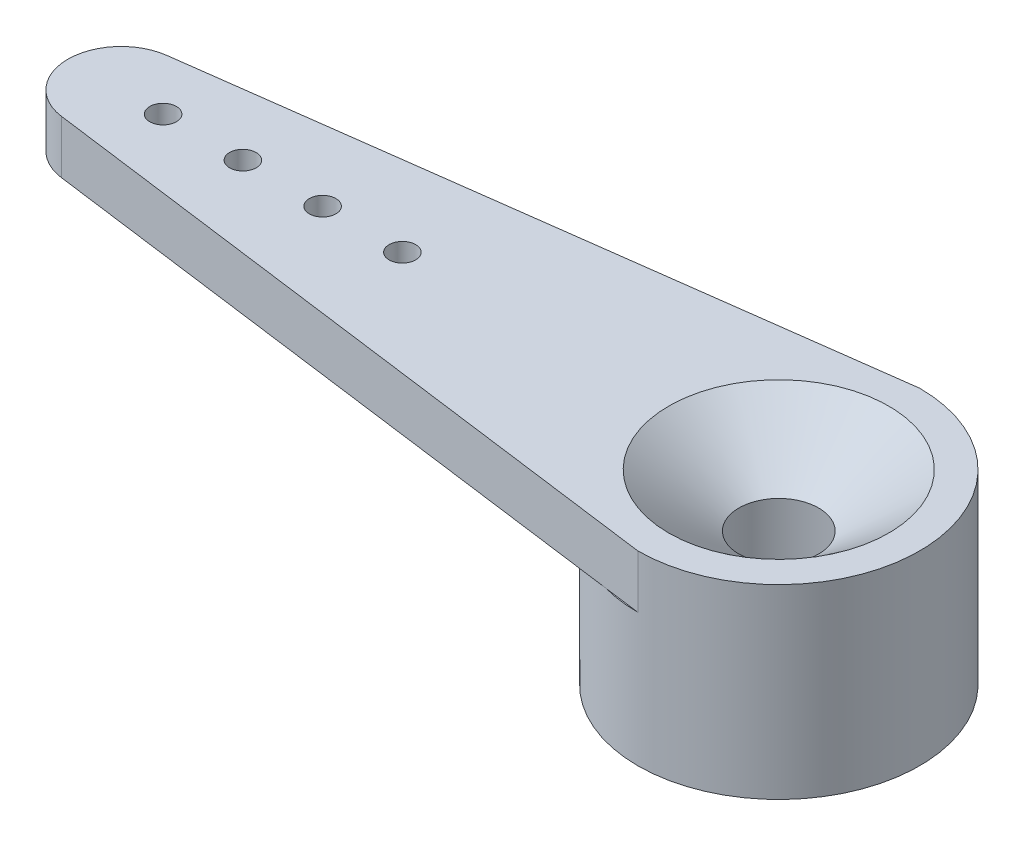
SolidWorks part; units mm, degrees
ref_plane "Front Plane" through (0, 0, 0) normal (0, 0, 1) x (1, 0, 0)
ref_plane "Top Plane" through (0, 0, 0) normal (0, 1, 0) x (1, 0, 0)
ref_plane "Right Plane" through (0, 0, 0) normal (1, 0, 0) x (0, 0, -1)
sketch "Sketch1" plane through (0, 0, 0) normal (0, 1, 0) x (1, 0, 0)
  circle A0 centre (0, 0) radius 2.8
  circle A1 centre (0, 0) radius 5.3
  dimension "D1" = 5.6
  dimension "D2" = 2.5
extrude "Boss-Extrude1" add sketch "Sketch1" along normal blind 5
sketch "Sketch4" plane through (0, 5, 0) normal (0, 1, 0) x (1, 0, 0)
  circle A0 centre (0, 0) radius 1.5
  dimension "D1" = 3
sketch "Sketch2" plane through (0, 5, 0) normal (0, 1, 0) x (1, 0, 0)
  line L0 (0, 5.3) -> (-25, 1.9824)
  line L1 (0, -5.3) -> (-25, -1.9824)
  circle A0 centre (0, 0) radius 5.3 construction
  arc A1 (-25, -1.9824) -> (-25, 1.9824) centre (-24.7354, 0) cw
  arc A2 (0, 5.3) -> (0, -5.3) centre (0, 0) cw
  point P8 (0, 0)
  dimension "D3" = 2
  dimension "D1" = 25
  dimension "D2" = 25
extrude "Boss-Extrude2" add sketch "Sketch2" along normal blind 2
sketch "Sketch3" plane through (0, 7, 0) normal (0, 1, 0) x (1, 0, 0)
  circle A0 centre (0, 0) radius 4.1381
loft "Cut-Loft2" cut profiles "Sketch3", "Sketch4"
sketch "Sketch5" plane through (0, 7, 0) normal (0, 1, 0) x (1, 0, 0)
  circle A0 centre (-23.1558, 0) radius 0.5
  dimension "D1" = 1
extrude "Cut-Extrude1" cut sketch "Sketch5" against normal up to next
pattern_linear "LPattern1" count 4 spacing 3 along (1, 0, 0) of "Cut-Extrude1"
